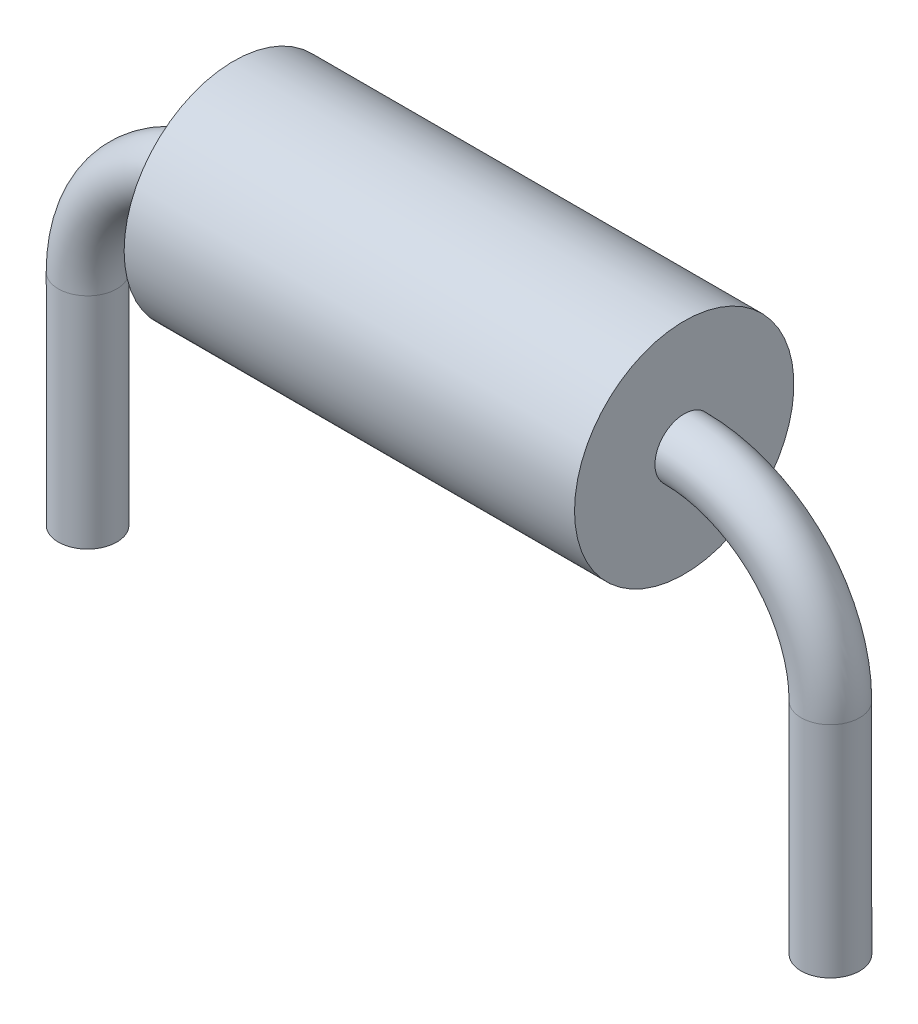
SolidWorks part; units mm, degrees
ref_plane "XY-Vorderansicht" through (0, 0, 0) normal (0, 0, 1) x (1, 0, 0)
ref_plane "XZ-Draufsicht" through (0, 0, 0) normal (0, 1, 0) x (1, 0, 0)
ref_plane "YZ-Seitenansicht" through (0, 0, 0) normal (1, 0, 0) x (0, 0, -1)
sketch "Skizze1" plane through (0, 0, 0) normal (0, 0, 1) x (1, 0, 0)
  line L0 (0, 0) -> (0, 3)
  line L1 (2, 5) -> (8.16, 5)
  line L2 (10.16, 3) -> (10.16, 0)
  arc A0 (0, 3) -> (2, 5) centre (2, 3) cw
  arc A1 (8.16, 5) -> (10.16, 3) centre (8.16, 3) cw
  point P7 (0, 5)
  point P10 (10.16, 5)
  dimension "D3" = 2
  dimension "D1" = 5
  dimension "D2" = 10.16
sketch "Skizze2" plane through (0, 0, 0) normal (0, 1, 0) x (1, 0, 0)
  circle A0 centre (0, 0) radius 0.4
  dimension "D1" = 0.8
sweep "Austragung1" add profiles "Skizze2" path "Skizze1"
sketch "Skizze3" plane through (0, 0, 0) normal (0, 0, 1) x (1, 0, 0)
  line L1 (2, 6.5) -> (8.16, 6.5)
  line L2 (2, 6.5) -> (2, 5)
  line L3 (2, 5) -> (8.16, 5)
  line L4 (8.16, 6.5) -> (8.16, 5)
  dimension "D1" = 1.5
revolve "Rotation1" add sketch "Skizze3" angle 360 about L3
